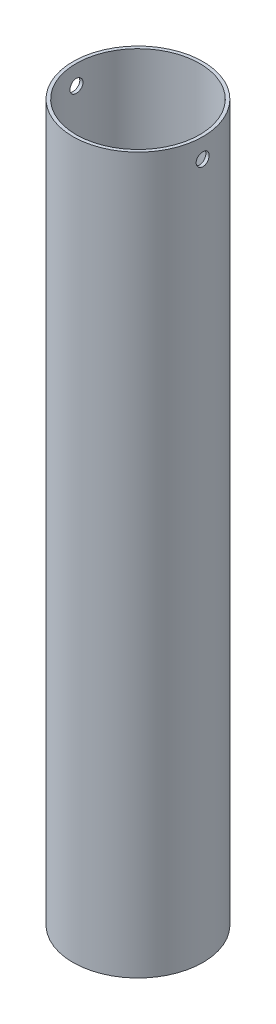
SolidWorks part; units mm, degrees
ref_plane "Спереди" through (0, 0, 0) normal (0, 0, 1) x (1, 0, 0)
ref_plane "Сверху" through (0, 0, 0) normal (0, 1, 0) x (1, 0, 0)
ref_plane "Справа" through (0, 0, 0) normal (1, 0, 0) x (0, 0, -1)
sketch "Эскиз1" plane through (0, 0, 0) normal (0, 1, 0) x (1, 0, 0)
  line L0 (0, 22.3695) -> (0, -17.1692) construction
  line L1 (-13.6288, 0) -> (13.6854, 0) construction
  circle A0 centre (0, 0) radius 10
  circle A1 centre (0, 0) radius 9.5
  dimension "D1" = 20
  dimension "D2" = 0.5
extrude "Бобышка-Вытянуть1" add sketch "Эскиз1" against normal blind 110
sketch "Эскиз2" plane through (0, 0, 0) normal (1, 0, 0) x (0, 0, -1)
  line L0 (10, 0) -> (-10, 0) construction
  circle A0 centre (0, -3) radius 1
  dimension "D1" = 2
  dimension "D2" = 3
extrude "Вырез-Вытянуть1" cut sketch "Эскиз2" against normal mid plane 30
